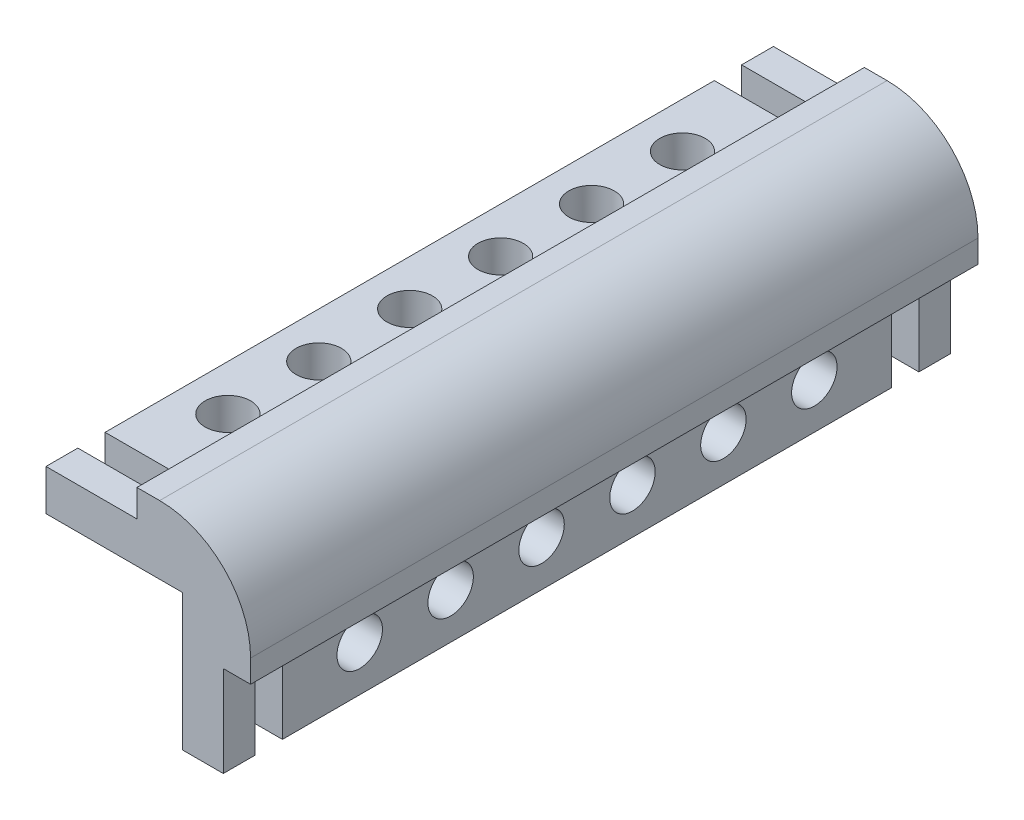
SolidWorks part; units mm, degrees
ref_plane "Front Plane" through (0, 0, 0) normal (0, 0, 1) x (1, 0, 0)
ref_plane "Top Plane" through (0, 0, 0) normal (0, 1, 0) x (1, 0, 0)
ref_plane "Right Plane" through (0, 0, 0) normal (1, 0, 0) x (0, 0, -1)
sketch "Sketch1" plane through (0, 0, 0) normal (0, 0, 1) x (1, 0, 0)
  line L0 (0, 0) -> (30, 0)
  line L1 (30, 0) -> (30, -30)
  dimension "D1" = 30
  dimension "D2" = 30
extrude "Extrude-Thin1" add sketch "Sketch1" along normal mid plane 160 thin
fillet "Fillet1" radius 20 1 edges at (45, 15, 0)
sketch "Sketch2" plane through (0, 0, 80) normal (0, 0, 1) x (1, 0, 0)
  line L0 (45, -5) -> (45, -30) construction
  line L1 (45, -10) -> (39, -10)
  line L2 (45, -10) -> (45, -30)
  line L3 (45, -30) -> (39, -30)
  line L4 (39, -10) -> (39, -30)
  line L5 (45, -30) -> (30, -30) construction
  line L7 (0, 15) -> (20, 15)
  line L8 (0, 15) -> (0, 9)
  line L9 (0, 9) -> (20, 9)
  line L10 (20, 15) -> (20, 9)
  dimension "D1" = 6
  dimension "D2" = 20
  dimension "D3" = 6
  dimension "D4" = 20
extrude "Cut-Extrude1" cut sketch "Sketch2" against normal through all both and the other way through all
sketch "Sketch3" plane through (39, 0, 0) normal (1, 0, 0) x (0, 0, -1)
  line L0 (0, -30) -> (0, 15) construction
  line L1 (80, -30) -> (-80, -30) construction
  line L2 (-80, 15) -> (80, 15) construction
  circle A1 centre (50, -20) radius 5
  circle A2 centre (30, -20) radius 5
  circle A3 centre (-30, -20) radius 5
  circle A4 centre (-50, -20) radius 5
  circle A6 centre (10, -20) radius 5
  circle A7 centre (-10, -20) radius 5
  point P6 (0, 0)
  point P7 (0, 0)
  point P10 (0, 0)
  point P11 (0, 0)
  point P14 (0, 0)
  point P15 (0, 0)
  point P20 (0, 0)
  point P21 (-90, -20)
  point P26 (-110, -20)
  point P27 (-119.2465, -45.6756)
  point P28 (-50, -20)
  dimension "D3" = 20
  dimension "D1" = 10
  dimension "D2" = 10
  dimension "D5" = 20
  dimension "D4" = 20
extrude "Cut-Extrude2" cut sketch "Sketch3" against normal blind 10
sketch "Sketch4" plane through (0, 9, 0) normal (0, 1, 0) x (1, 0, 0)
  line L0 (0, 0) -> (45, 0) construction
  line L1 (0, 80) -> (0, -80) construction
  line L2 (45, 80) -> (45, -80) construction
  line L3 (20, 80) -> (20, -80) construction
  line L4 (0, 80) -> (20, 80) construction
  circle A1 centre (10, -50) radius 5
  circle A2 centre (10, -30) radius 5
  circle A3 centre (10, -10) radius 5
  circle A4 centre (10, 10) radius 5
  circle A5 centre (10, 30) radius 5
  circle A6 centre (10, 50) radius 5
  point P8 (0, 0)
  dimension "D1" = 10
  dimension "D3" = 30
  dimension "D5" = 20
  dimension "D2" = 10
  dimension "D4" = 50
extrude "Cut-Extrude3" cut sketch "Sketch4" against normal blind 10
sketch "Sketch6" plane through (0, -30, 0) normal (0, -1, 0) x (1, 0, 0)
  line L0 (0, 70) -> (39, 70)
  line L1 (0, 80) -> (0, -80) construction
  line L2 (39, -80) -> (39, 80) construction
  dimension "D1" = 10
extrude "Cut-Extrude-Thin1" cut sketch "Sketch6" against normal up to surface and the other way through all thin
mirror "Mirror1" about plane through (0, 0, 0) normal (0, 0, 1) of "Cut-Extrude-Thin1"
